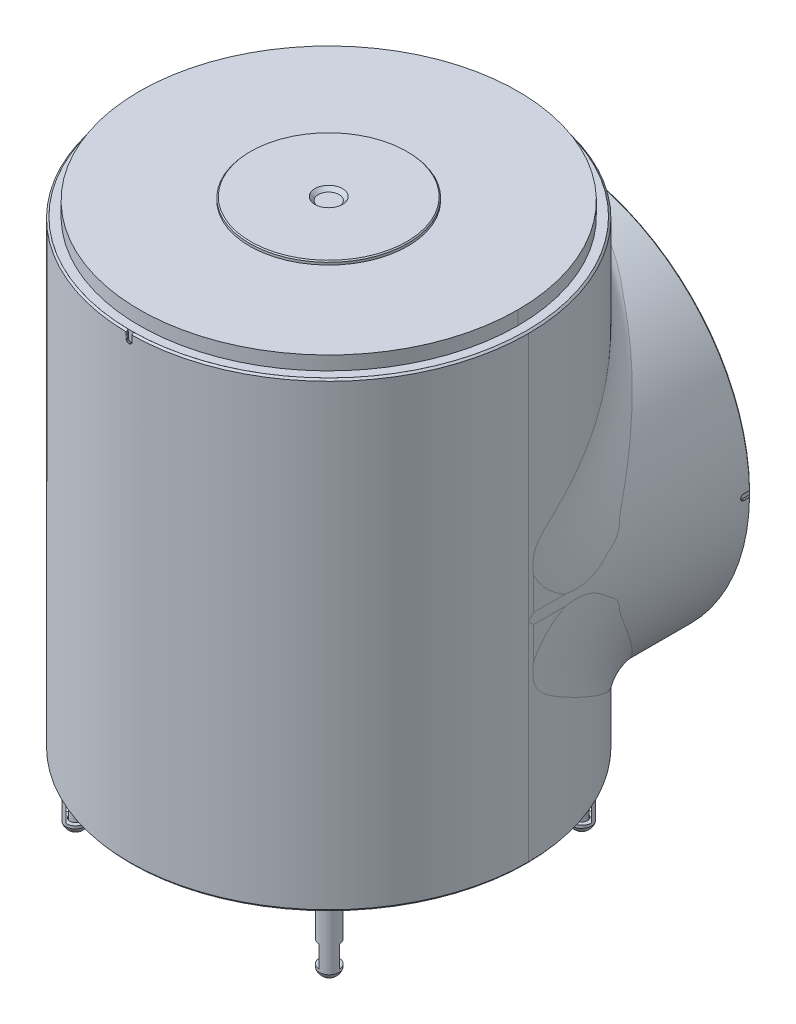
SolidWorks part; units mm, degrees
ref_plane "前视基准面" through (0, 0, 0) normal (0, 0, 1) x (1, 0, 0)
ref_plane "上视基准面" through (0, 0, 0) normal (0, 1, 0) x (1, 0, 0)
ref_plane "右视基准面" through (0, 0, 0) normal (1, 0, 0) x (0, 0, -1)
imported_body "25关节1.STEP"
sketch "草图2" plane through (0, 0, -61) normal (0, 0, -1) x (-1, 0, 0)
  circle A0 centre (0, -56.1) radius 55
extrude "凸台-拉伸1" add sketch "草图2" against normal blind 50
ref_plane "基准面2" through (0, -150, 0) normal (0, 1, 0) x (1, 0, 0)
sketch "草图3" plane through (0, -150, 0) normal (0, 1, 0) x (1, 0, 0)
  circle A0 centre (0, 0) radius 65.4734
  circle A1 centre (-36.6934, -36.8455) radius 2.85
  circle A2 centre (36.8455, -36.6934) radius 2.85
  circle A3 centre (36.6934, 36.8455) radius 2.85
  circle A4 centre (-36.8455, 36.6934) radius 2.85
extrude "切除-拉伸1" cut sketch "草图3" along normal blind 32.8
